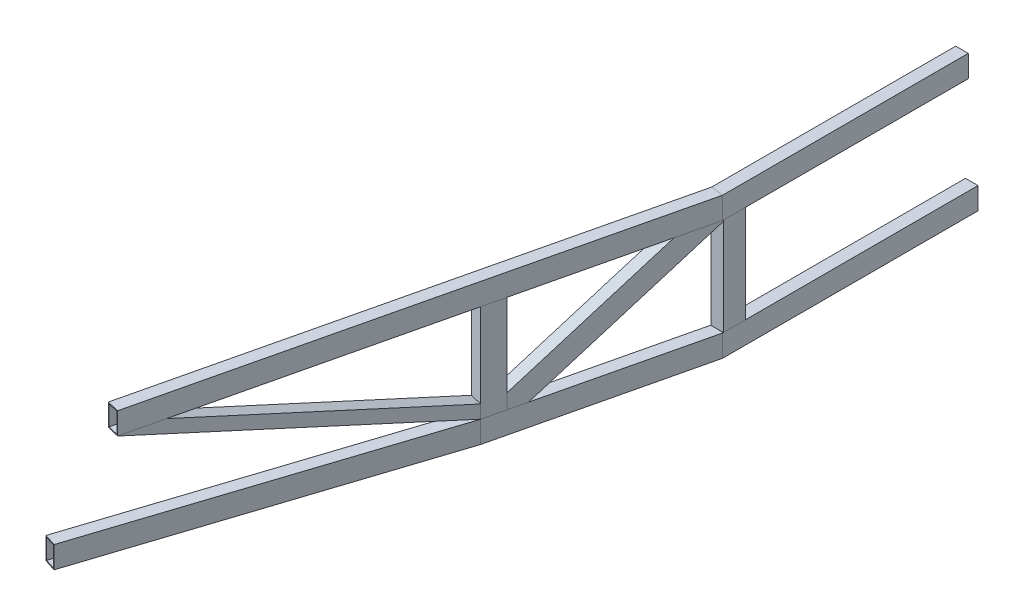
SolidWorks part; units mm, degrees
ref_plane "Front Plane" through (0, 0, 0) normal (0, 0, 1) x (1, 0, 0)
ref_plane "Top Plane" through (0, 0, 0) normal (0, 1, 0) x (1, 0, 0)
ref_plane "Right Plane" through (0, 0, 0) normal (1, 0, 0) x (0, 0, -1)
sketch3d "3DSketch1"
  line L1 (0, 0, 0) -> (158.75, 0, 0)
  line L3 (0, 381, -88.9) -> (0, 0, 0)
  line L7 (584.2, 0, -2461.26) -> (584.2, 0.0001, -1648.46)
  line L10 (584.2, 0.0001, -1648.46) -> (436.88, 0, -1026.16)
  line L11 (436.88, 0, -1026.16) -> (102.87, 0, 0)
  line L14 (584.2, 0.0001, -1648.46) -> (584.2, 381.0001, -1648.46)
  line L15 (436.88, 0, -1026.16) -> (436.88, 381, -1026.16)
  line L17 (0, 381, -88.9) -> (317.5, 381, -88.9)
  line L20 (584.2, 381.0001, -1648.46) -> (214.998, 381, -88.9)
  line L26 (584.2, 381.0001, -1648.46) -> (584.2, 381, -2430.1781)
  line L27 (584.2, 0, -1976.12) -> (584.2, 507.7637, -2581.2492)
  line L30 (584.2, 0, -2296.16) -> (584.2, 268.5455, -2296.16)
  line L92 (584.2, 0, -1976.12) -> (584.2, 381.0001, -1648.46)
  line L93 (584.2, 381.0001, -1648.46) -> (436.88, 0, -1026.16)
  dimension "D12" = 102.87
  dimension "D14" = 639.5002
  dimension "D15" = 1079.1511
  dimension "D25" = 327.66
  dimension "D27" = 647.7
  dimension "D72" = 812.8
other "Structural Member1"
ref_plane "Plane1" through (584.2, 381.0001, -1648.46) normal (0, 0, -1) x (1, 0, 0)
sketch "Sketch1" plane through (584.2, 381.0001, -1648.46) normal (0, 0, -1) x (1, 0, 0)
  line L1 (-17, 32) -> (17, 32)
  line L2 (-17, 32) -> (-17, -32)
  line L3 (-17, -32) -> (17, -32)
  line L4 (17, 32) -> (17, -32)
  line L5 (-17, 32) -> (17, -32) construction
  line L6 (-17, -32) -> (17, 32) construction
  line L7 (-20, 35) -> (20, 35)
  line L8 (-20, 35) -> (-20, -35)
  line L9 (-20, -35) -> (20, -35)
  line L10 (20, 35) -> (20, -35)
  line L11 (-20, 35) -> (20, -35) construction
  line L12 (-20, -35) -> (20, 35) construction
  point P0 (0, 0)
  point P6 (0, 0)
  point P11 (0, 32)
  point P12 (0, 35)
  point P13 (-17, 0)
  point P14 (-20, 0)
  point P15 (17, 0)
  point P16 (20, 0)
  point P17 (0, -35)
  point P18 (0, -32)
  point P19 (0, 0)
  dimension "D1" = 3
  dimension "D4" = 40
  dimension "D2" = 3
  dimension "D3" = 70
other "Trim/Extend1"
sketch3d "3DSketch2"
  line L0 (214.998, 346, -88.9) -> (436.88, 35, -1026.16)
  line L1 (234.4601, 346, -84.2927) -> (195.536, 346, -93.5074) construction
  line L2 (417.6075, 35, -1031.5679) -> (456.1525, 35, -1020.7521) construction
other "Structural Member3"
ref_plane "Plane5" through (214.998, 346, -88.9) normal (0.2192, -0.3073, -0.926) x (0.3503, 0.9106, -0.2192)
sketch "Sketch14" plane through (214.998, 346, -88.9) normal (0.2192, -0.3073, -0.926) x (0.3503, 0.9106, -0.2192)
  line L1 (-17, 17) -> (17, 17)
  line L2 (-17, 17) -> (-17, -17)
  line L3 (-17, -17) -> (17, -17)
  line L4 (17, 17) -> (17, -17)
  line L5 (-17, 17) -> (17, -17) construction
  line L6 (-17, -17) -> (17, 17) construction
  line L7 (-20, 20) -> (20, 20)
  line L8 (-20, 20) -> (-20, -20)
  line L9 (-20, -20) -> (20, -20)
  line L10 (20, 20) -> (20, -20)
  line L11 (-20, 20) -> (20, -20) construction
  line L12 (-20, -20) -> (20, 20) construction
  point P0 (0, 0)
  point P6 (0, 0)
  point P11 (0, 17)
  point P12 (0, 20)
  point P13 (-17, 0)
  point P14 (-20, 0)
  point P15 (17, 0)
  point P16 (20, 0)
  point P17 (0, -20)
  point P18 (0, -17)
  point P19 (0, 0)
  dimension "D1" = 3
  dimension "D4" = 40
  dimension "D2" = 3
  dimension "D3" = 40
other "Trim/Extend2"
